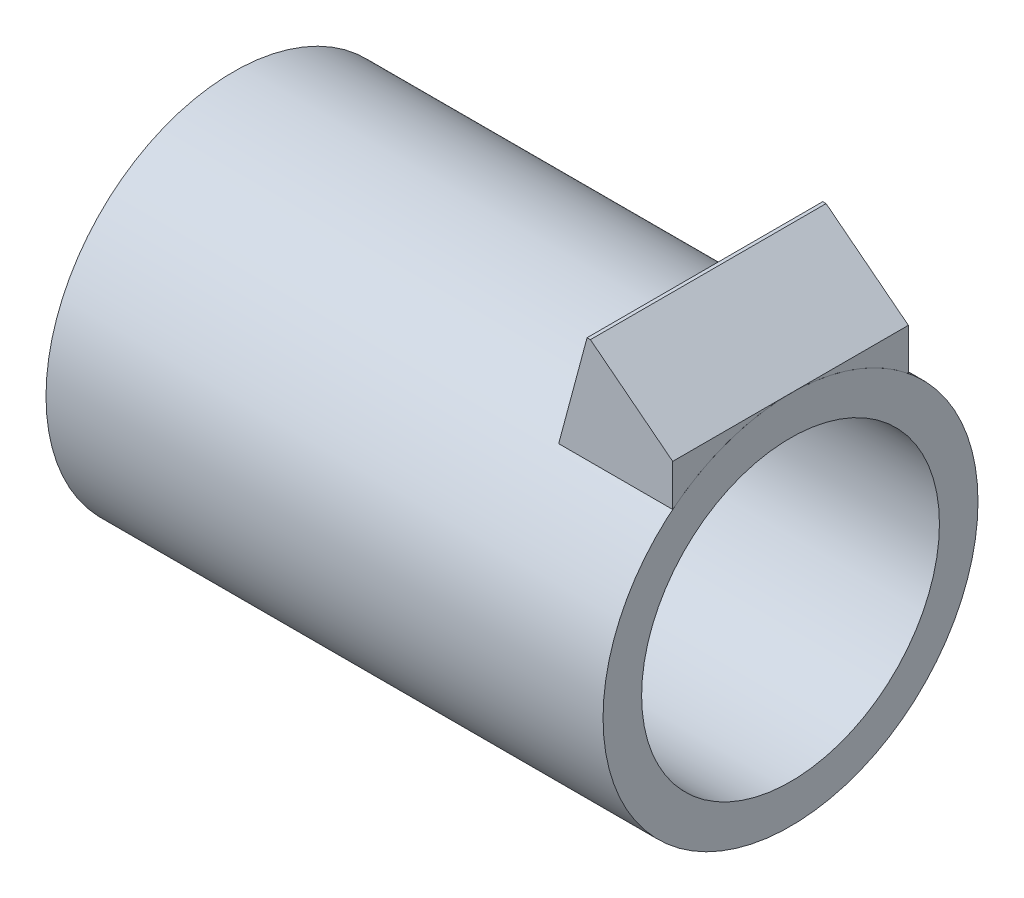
SolidWorks part; units mm, degrees
ref_plane "Спереди" through (0, 0, 0) normal (0, 0, 1) x (1, 0, 0)
ref_plane "Сверху" through (0, 0, 0) normal (0, 1, 0) x (1, 0, 0)
ref_plane "Справа" through (0, 0, 0) normal (1, 0, 0) x (0, 0, -1)
sketch "Поршень" plane through (0, 0, 0) normal (0, 0, 1) x (1, 0, 0)
  line L0 (15.9537, 0) -> (-15.9537, 0) construction
  line L1 (0, 2.9) -> (0, 8.75)
  line L2 (0, 8.75) -> (26, 8.75)
  line L3 (26, 8.75) -> (26, 6.95)
  line L4 (26, 0) -> (26, 6.95) construction
  line L6 (26, 6.95) -> (1.6, 6.95)
  line L7 (1.6, 6.95) -> (1.6, 0)
  line L8 (1.6, 0) -> (-3.8, 0)
  line L9 (0, 2.9) -> (-1.9, 2.9)
  line L10 (0, 0) -> (0, 4.6) construction
  line L13 (-1.9, 2.9) -> (-3.8, 2.9) construction
  line L15 (-3.8, 0) -> (-3.8, 3.25)
  line L16 (-1.9, 2.9) -> (-1.9, 4.6)
  line L17 (-3.8, 3.25) -> (-1.9, 4.6)
  line L19 (22, -989.1336) -> (22, 49010.8664) construction
  line L22 (-976.8609, 10.55) -> (49023.1391, 10.55) construction
  point P4 (0, 0)
  dimension "D1" = 26
  dimension "D2" = 8.75
  dimension "D3" = 1.8
  dimension "D4" = 24.4
  dimension "D5" = 1.9
  dimension "D6" = 3.25
  dimension "D7" = 1.9
  dimension "D8" = 1.7
  dimension "D9" = 2.9
revolve "Повернуть3" add sketch "Поршень" angle 360 about L0
sketch "Зуб" plane through (26, 0, 0) normal (1, 0, 0) x (0, 0, -1)
  line L0 (-1000, 0) -> (49000, 0) construction
  line L1 (-5.5, 11.75) -> (-5.5, 6.8053)
  line L3 (-3.9, 8.75) -> (3.9, 8.75) construction
  line L4 (0, 8.75) -> (0, 11.75) construction
  line L5 (0, -200989.1336) -> (0, 249010.8664) construction
  line L6 (-5.5, 11.75) -> (5.5, 11.75)
  line L7 (5.5, 11.75) -> (5.5, 6.8053)
  circle A1 centre (0, 0) radius 8.75 construction
  arc A4 (5.5, 6.8053) -> (-5.5, 6.8053) centre (0, 0) ccw
  point P17 (0, 8.75)
  dimension "D1" = 3
  dimension "D2" = 11
extrude "Бобышка-Вытянуть3" add sketch "Зуб" against normal blind 4.8 separate body
ref_plane "Плоскость_база_зуб" through (0, 11.75, 0) normal (0, 1, 0) x (1, 0, 0)
ref_plane "Плоскость1" through (0, 8.75, 0) normal (0, 1, 0) x (1, 0, 0)
ref_plane "Плоскость3" through (26, 0, 0) normal (-1, 0, 0) x (0, 0, 1)
draft "Уклон1" type of draft neutral plane draft angle 15 neutral plane "Плоскость1" faces to draft 1 parameters "D1"=15
draft "Уклон2" type of draft neutral plane draft angle 52 neutral plane "Плоскость1" faces to draft 1 parameters "D1"=52
other "Пересечение1"
